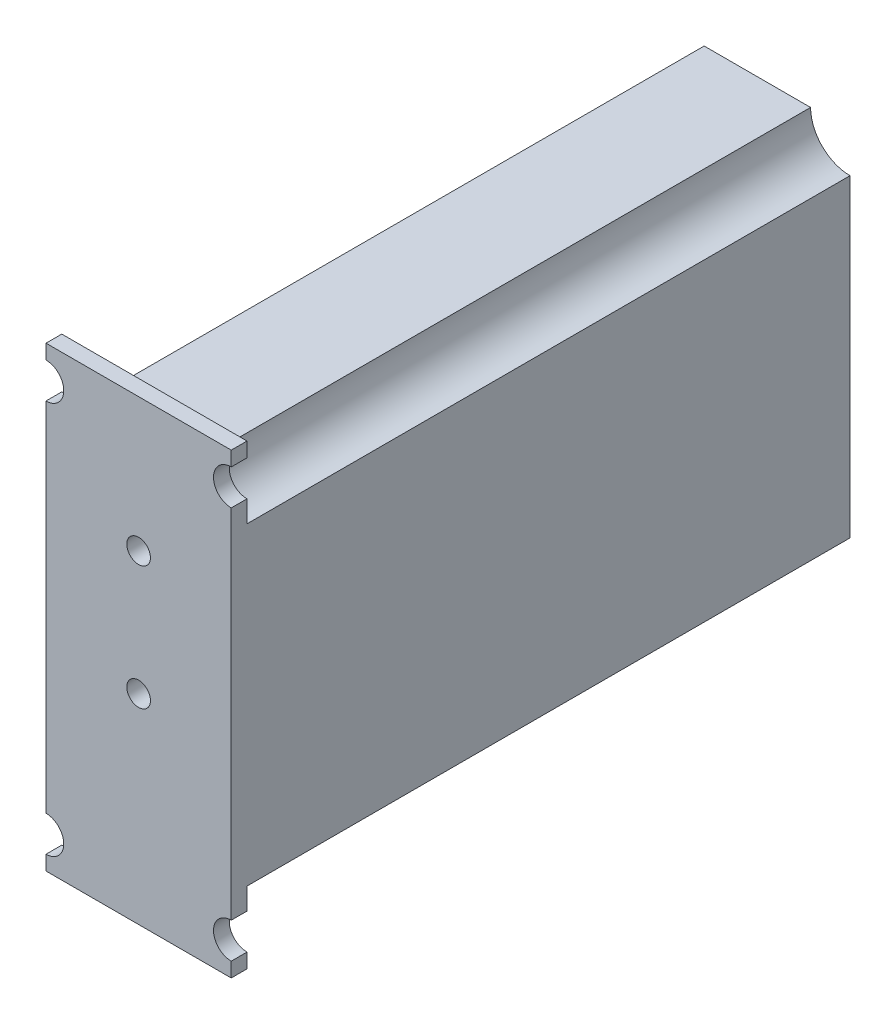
SolidWorks part; units mm, degrees
ref_plane "Front Plane" through (0, 0, 0) normal (0, 0, 1) x (1, 0, 0)
ref_plane "Top Plane" through (0, 0, 0) normal (0, 1, 0) x (1, 0, 0)
ref_plane "Right Plane" through (0, 0, 0) normal (1, 0, 0) x (0, 0, -1)
sketch "Sketch1" plane through (0, 0, 0) normal (0, 0, 1) x (1, 0, 0)
  line L0 (0, 0) -> (0, 12.6492) construction
  line L1 (-5.969, 12.6492) -> (5.969, 12.6492)
  line L2 (5.969, 12.6492) -> (5.969, -12.6492)
  line L3 (-5.969, 12.6492) -> (-5.969, -12.6492)
  line L4 (0, 0) -> (5.969, 0) construction
  line L5 (-5.969, -12.6492) -> (5.969, -12.6492)
  point P9 (-5.969, 0)
  dimension "D1" = 5.969
  dimension "D2" = 12.6492
extrude "body" add sketch "Sketch1" along normal blind 38.862
sketch "Sketch3" plane through (0, 0, 0) normal (0, 0, -1) x (-1, 0, 0)
  line L0 (0, 0) -> (0, 12.6492) construction
  line L1 (-5.969, 12.6492) -> (5.969, 12.6492) construction
  line L2 (0, 0) -> (5.969, 0) construction
  line L3 (5.969, 12.6492) -> (5.969, -12.6492) construction
  circle A0 centre (-5.969, 12.6492) radius 2.54
  circle A1 centre (5.969, 12.6492) radius 2.54
  circle A2 centre (5.969, -12.6492) radius 2.54
  circle A3 centre (-5.969, -12.6492) radius 2.54
  dimension "D1" = 5.08
extrude "Cut-Extrude1" cut sketch "Sketch3" against normal through all
sketch "Sketch2" plane through (0, 0, 38.862) normal (0, 0, 1) x (1, 0, 0)
  line L0 (0, 0) -> (0, 14.732) construction
  line L1 (-5.969, 14.732) -> (5.969, 14.732)
  line L2 (5.969, 14.732) -> (5.969, -14.732)
  line L3 (5.969, -10.1092) -> (5.969, 10.1092) construction
  line L4 (-5.969, 14.732) -> (-5.969, -14.732)
  line L5 (0, 0) -> (5.969, 0) construction
  line L6 (-5.969, -14.732) -> (5.969, -14.732)
  point P11 (-5.969, 0)
  dimension "D1" = 14.732
extrude "base" add sketch "Sketch2" along normal blind 1.016
sketch "Sketch4" plane through (0, 0, 38.862) normal (0, 0, -1) x (-1, 0, 0)
  line L0 (0, 0) -> (0, 14.732) construction
  line L1 (-5.969, 14.732) -> (5.969, 14.732) construction
  line L2 (0, 0) -> (5.969, 0) construction
  line L3 (5.969, 10.1092) -> (5.969, -10.1092) construction
  circle A0 centre (-5.969, 12.6492) radius 1.143
  circle A1 centre (5.969, 12.6492) radius 1.143
  circle A2 centre (-5.969, -12.6492) radius 1.143
  circle A3 centre (5.969, -12.6492) radius 1.143
  dimension "D3" = 2.286
  dimension "D1" = 5.969
  dimension "D2" = 12.6492
extrude "mount_holes" cut sketch "Sketch4" against normal blind 7.62
sketch "Sketch5" plane through (0, 0, 39.878) normal (0, 0, 1) x (1, 0, 0)
  line L0 (0, 14.732) -> (0, 2.1336) construction
  line L1 (5.969, 14.732) -> (-5.969, 14.732) construction
  line L2 (0, 2.1336) -> (5.969, 2.1336) construction
  line L3 (5.969, -11.5062) -> (5.969, 11.5062) construction
  circle A0 centre (0, 6.1214) radius 0.762
  circle A1 centre (0, -1.8542) radius 0.762
  dimension "D2" = 1.524
  dimension "D3" = 3.9878
  dimension "D4" = 6.1214
  dimension "D1" = 12.5984
extrude "valve_holes" cut sketch "Sketch5" against normal blind 6.35
